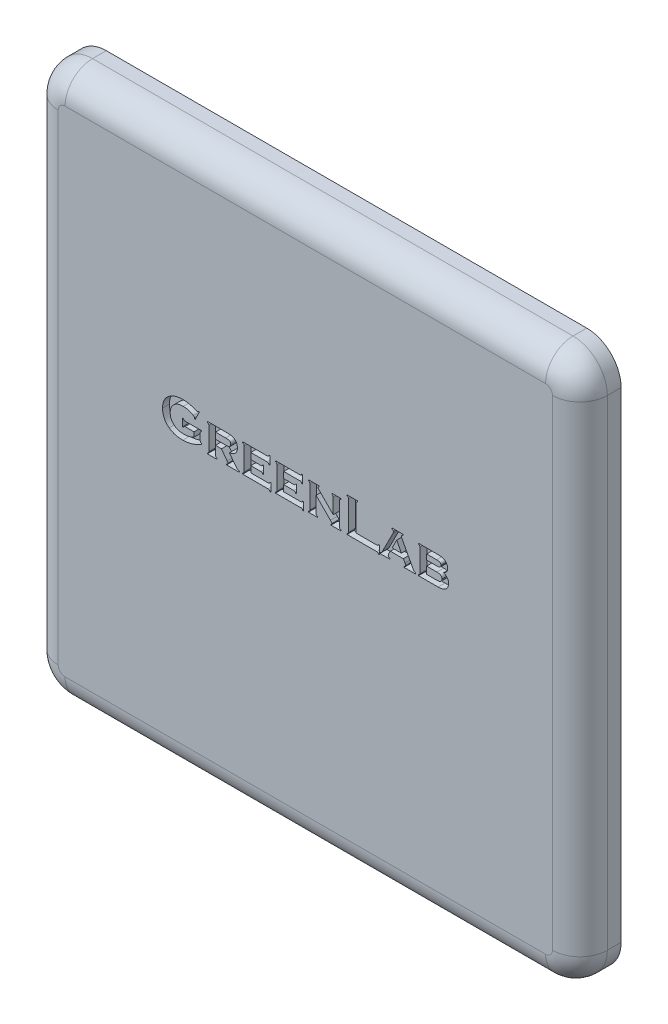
SolidWorks part; units mm, degrees
ref_plane "Front Plane" through (0, 0, 0) normal (0, 0, 1) x (1, 0, 0)
ref_plane "Top Plane" through (0, 0, 0) normal (0, 1, 0) x (1, 0, 0)
ref_plane "Right Plane" through (0, 0, 0) normal (1, 0, 0) x (0, 0, -1)
ref_plane "Plane1" through (0, 0, 3) normal (0, 0, 1) x (1, 0, 0)
sketch "Sketch1" plane through (0, 0, 3) normal (0, 0, 1) x (1, 0, 0)
  line L0 (17.5, -22.5) -> (17.5, 17.5)
  line L1 (17.5, 17.5) -> (-22.5, 17.5)
  line L2 (-22.5, 17.5) -> (-22.5, -22.5)
  line L3 (-22.5, -22.5) -> (17.5, -22.5)
  dimension "D1" = 40
  dimension "D2" = 40
extrude "Boss-Extrude1" add sketch "Sketch1" against normal blind 3
fillet "Fillet1" radius 2.5 4 edges at (-22.5, 17.5, 1.5) (17.5, 17.5, 1.5) (-22.5, -22.5, 1.5) (17.5, -22.5, 1.5)
fillet "Fillet2" radius 2 8 edges at (-21.7678, -21.7678, 3) (-22.5, -2.5, 3) (-2.5, -22.5, 3) (-21.7678, 16.7678, 3) (16.7678, -21.7678, 3) (-2.5, 17.5, 3) (17.5, -2.5, 3) (16.7678, 16.7678, 3)
sketch "Sketch2" plane through (0, 0, 3) normal (0, 0, 1) x (1, 0, 0)
  line L0 (-20.5, -1.25) -> (15.5, -1.25) construction
  line L1 (-20.5, 15) -> (-20.5, -20) construction
  line L2 (15.5, -20) -> (15.5, 15) construction
  line L3 (15, -22.5) -> (-20, -22.5) construction
  text T0 "GreenLab" font "Copperplate Gothic Bold" height 2.5
  dimension "D1" = 21.25
extrude "Cut-Extrude1" cut sketch "Sketch2" against normal blind 0.5
